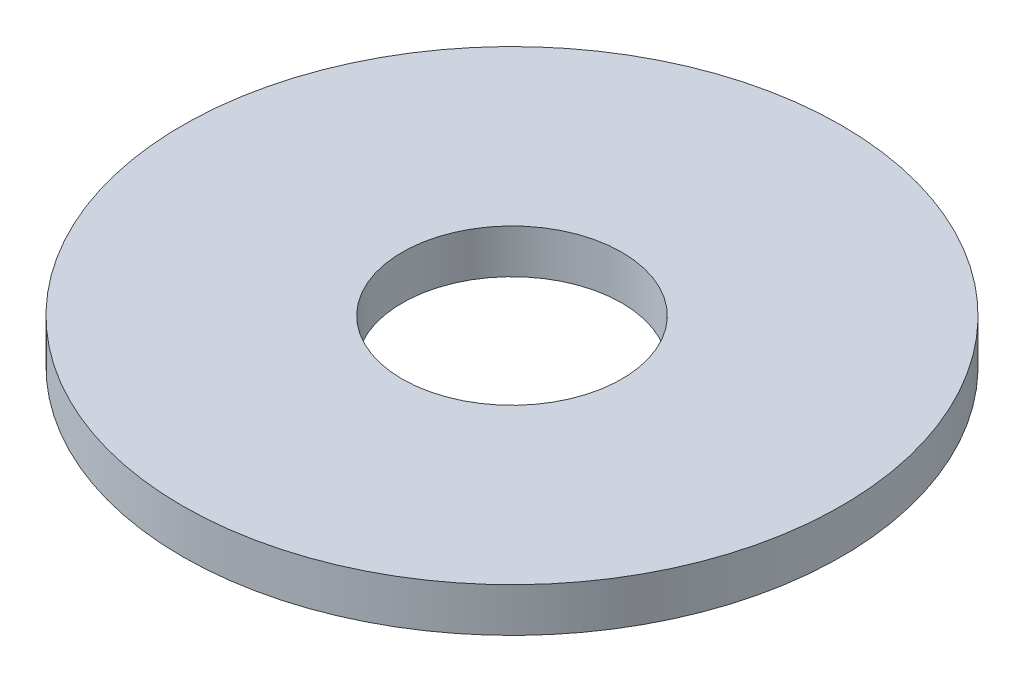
SolidWorks part; units mm, degrees
ref_plane "Front Plane" through (0, 0, 0) normal (0, 0, 1) x (1, 0, 0)
ref_plane "Top Plane" through (0, 0, 0) normal (0, 1, 0) x (1, 0, 0)
ref_plane "Right Plane" through (0, 0, 0) normal (1, 0, 0) x (0, 0, -1)
sketch "Sketch1" plane through (0, 0, 0) normal (0, 1, 0) x (1, 0, 0)
  circle A1 centre (0, 0) radius 9.525
  circle A2 centre (0, 0) radius 3.175
  dimension "D1" = 19.05
extrude "Boss-Extrude1" add sketch "Sketch1" along normal blind 1.27
